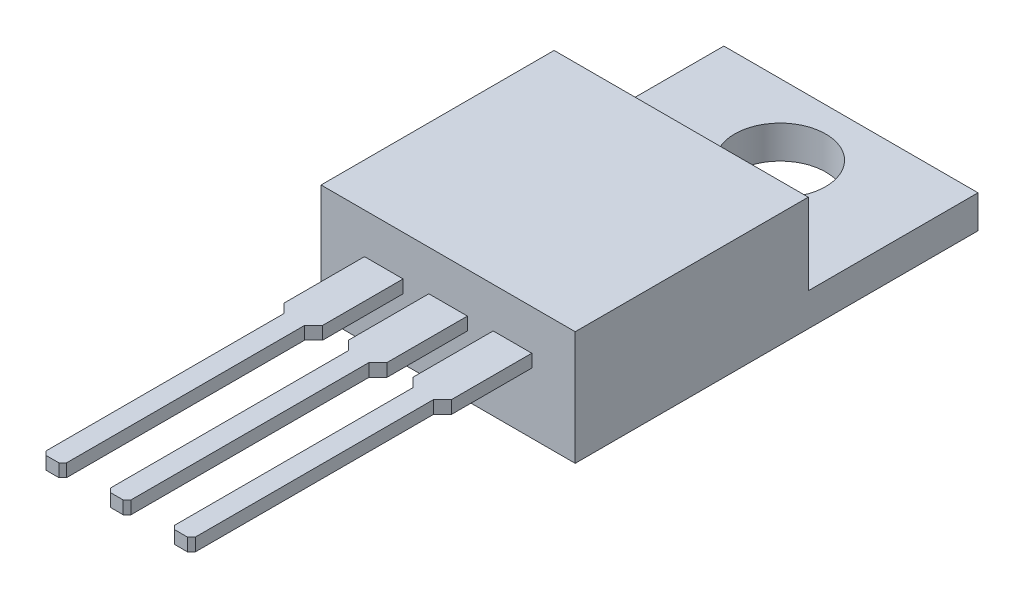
SolidWorks part; units mm, degrees
ref_plane "Front Plane" through (0, 0, 0) normal (0, 0, 1) x (1, 0, 0)
ref_plane "Top Plane" through (0, 0, 0) normal (0, 1, 0) x (1, 0, 0)
ref_plane "Right Plane" through (0, 0, 0) normal (1, 0, 0) x (0, 0, -1)
sketch "Sketch1" plane through (0, 0, 0) normal (0, 1, 0) x (1, 0, 0)
  line L0 (0, 2.794) -> (0, -13.1064) construction
  line L1 (-5.0165, 2.794) -> (5.0165, 2.794)
  line L2 (-5.0165, 2.794) -> (-5.0165, -13.1064)
  line L3 (-5.0165, -13.1064) -> (5.0165, -13.1064)
  line L4 (5.0165, 2.794) -> (5.0165, -13.1064)
  dimension "D1" = 10.033
  dimension "D2" = 2.794
  dimension "D3" = 13.1064
extrude "Extrude1" add sketch "Sketch1" along normal blind 1.3005
sketch "Sketch2" plane through (0, 1.3005, 0) normal (0, 1, 0) x (-1, 0, 0)
  circle A0 centre (0, 0) radius 1.7996
  dimension "D1" = 3.5992
extrude "Cut-Extrude1" cut sketch "Sketch2" against normal through all
sketch "Sketch3" plane through (0, 1.3005, 0) normal (0, 1, 0) x (-1, 0, 0)
  line L0 (-5.0165, 13.1064) -> (-5.0165, -2.794) construction
  line L1 (5.0165, 13.1064) -> (-5.0165, 13.1064)
  line L2 (5.0165, 13.1064) -> (5.0165, 3.9065)
  line L3 (5.0165, 3.9065) -> (-5.0165, 3.9065)
  line L4 (-5.0165, 13.1064) -> (-5.0165, 3.9065)
  dimension "D1" = 9.1999
extrude "Extrude2" add sketch "Sketch3" along normal blind 3.2004
sketch "Sketch4" plane through (0, 0, 13.1064) normal (0, 0, 1) x (1, 0, 0)
  line L0 (0, 2.9083) -> (0, 2.4003) construction
  line L1 (-3.302, 2.9083) -> (-1.778, 2.9083)
  line L2 (-3.302, 2.9083) -> (-3.302, 2.4003)
  line L3 (-3.302, 2.4003) -> (-1.778, 2.4003)
  line L4 (-1.778, 2.9083) -> (-1.778, 2.4003)
  line L5 (-0.762, 2.9083) -> (0.762, 2.9083)
  line L6 (-0.762, 2.9083) -> (-0.762, 2.4003)
  line L7 (-0.762, 2.4003) -> (0.762, 2.4003)
  line L8 (0.762, 2.9083) -> (0.762, 2.4003)
  line L9 (1.778, 2.9083) -> (3.302, 2.9083)
  line L10 (1.778, 2.9083) -> (1.778, 2.4003)
  line L11 (1.778, 2.4003) -> (3.302, 2.4003)
  line L12 (3.302, 2.9083) -> (3.302, 2.4003)
  dimension "D1" = 2.4003
  dimension "D2" = 1.524
  dimension "D3" = 0.508
  dimension "D4" = 2.54
  dimension "D5" = 2.54
extrude "Extrude3" add sketch "Sketch4" along normal blind 13.081
sketch "Sketch5" plane through (0, 2.9083, 0) normal (0, 1, 0) x (-1, 0, 0)
  line L0 (-3.302, 16.2814) -> (-2.9464, 16.637)
  line L1 (-3.302, 26.1874) -> (-3.302, 13.1064) construction
  line L2 (2.9464, 16.637) -> (2.9464, 26.035)
  line L3 (2.9464, 26.035) -> (2.794, 26.1874)
  line L4 (-2.1336, 16.637) -> (-1.778, 16.2814)
  line L5 (-1.778, 26.1874) -> (-1.778, 13.1064) construction
  line L6 (-1.778, 16.2814) -> (-0.762, 16.2814)
  line L7 (-0.762, 26.1874) -> (-0.762, 13.1064) construction
  line L8 (-0.762, 16.2814) -> (-0.4064, 16.637)
  line L9 (0.4064, 16.637) -> (0.4064, 26.035)
  line L10 (-0.762, 26.1874) -> (0.762, 26.1874) construction
  line L11 (0.4064, 16.637) -> (0.762, 16.2814)
  line L12 (0.762, 26.1874) -> (0.762, 13.1064) construction
  line L13 (0.762, 16.2814) -> (1.778, 16.2814)
  line L14 (1.778, 26.1874) -> (1.778, 13.1064) construction
  line L15 (1.778, 16.2814) -> (2.1336, 16.637)
  line L16 (2.794, 26.1874) -> (2.286, 26.1874)
  line L17 (2.286, 26.1874) -> (2.1336, 26.035)
  line L18 (2.9464, 16.637) -> (3.302, 16.2814)
  line L19 (3.302, 26.1874) -> (3.302, 13.1064) construction
  line L20 (3.302, 16.2814) -> (3.556, 16.2814)
  line L21 (3.556, 16.2814) -> (3.556, 26.4414)
  line L22 (3.556, 26.4414) -> (-3.556, 26.4414)
  line L23 (-3.556, 26.4414) -> (-3.556, 16.2814)
  line L24 (-3.556, 16.2814) -> (-3.302, 16.2814)
  line L25 (0, 26.1874) -> (0, 13.1064) construction
  line L26 (5.0165, 13.1064) -> (-5.0165, 13.1064) construction
  line L27 (0.4064, 26.035) -> (0.254, 26.1874)
  line L28 (0.254, 26.1874) -> (-0.254, 26.1874)
  line L29 (-0.254, 26.1874) -> (-0.4064, 26.035)
  line L30 (-0.4064, 26.035) -> (-0.4064, 16.637)
  line L31 (2.1336, 26.035) -> (2.1336, 16.637)
  line L32 (-2.1336, 16.637) -> (-2.1336, 26.035)
  line L33 (-2.1336, 26.035) -> (-2.286, 26.1874)
  line L34 (-2.286, 26.1874) -> (-2.794, 26.1874)
  line L35 (-2.794, 26.1874) -> (-2.9464, 26.035)
  line L36 (-2.9464, 26.035) -> (-2.9464, 16.637)
  line L37 (1.778, 26.1874) -> (3.302, 26.1874) construction
  line L38 (0, 26.1874) -> (0, 26.4414) construction
  dimension "D1" = 0.8128
  dimension "D2" = 135
  dimension "D3" = 135
  dimension "D4" = 0.508
  dimension "D5" = 0.254
  dimension "D6" = 3.175
  dimension "D7" = 7.112
extrude "Cut-Extrude2" cut sketch "Sketch5" against normal through all
